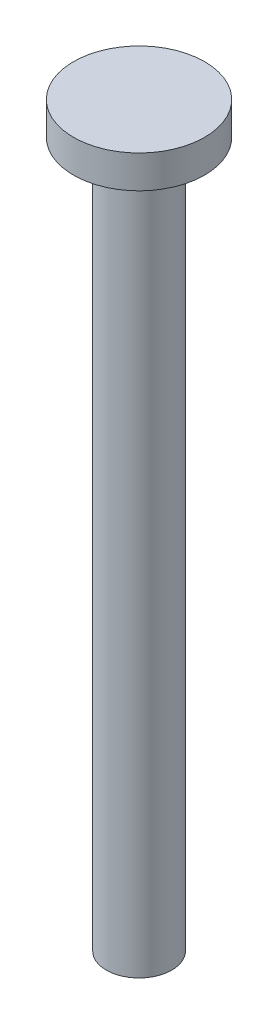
SolidWorks part; units mm, degrees
ref_plane "Płaszczyzna przednia" through (0, 0, 0) normal (0, 0, 1) x (1, 0, 0)
ref_plane "Płaszczyzna górna" through (0, 0, 0) normal (0, 1, 0) x (1, 0, 0)
ref_plane "Płaszczyzna prawa" through (0, 0, 0) normal (1, 0, 0) x (0, 0, -1)
sketch "Szkic2" plane through (0, 0, 0) normal (0, 0, 1) x (1, 0, 0)
  line L0 (-9.3361, 39.4001) -> (-17.3361, 39.4001)
  line L1 (-17.3361, 39.4001) -> (-17.3361, 35.4001)
  line L2 (-17.3361, 35.4001) -> (-13.3361, 35.4001)
  line L3 (-13.3361, 35.4001) -> (-13.3361, -50.5999)
  line L4 (-13.3361, -50.5999) -> (-9.3361, -50.5999)
  line L5 (-9.3361, -50.5999) -> (-9.3361, 39.4001)
  dimension "D1" = 8
  dimension "D2" = 4
  dimension "D3" = 90
  dimension "D4" = 4
revolve "Obrót1" add sketch "Szkic2" angle 360 about L5
